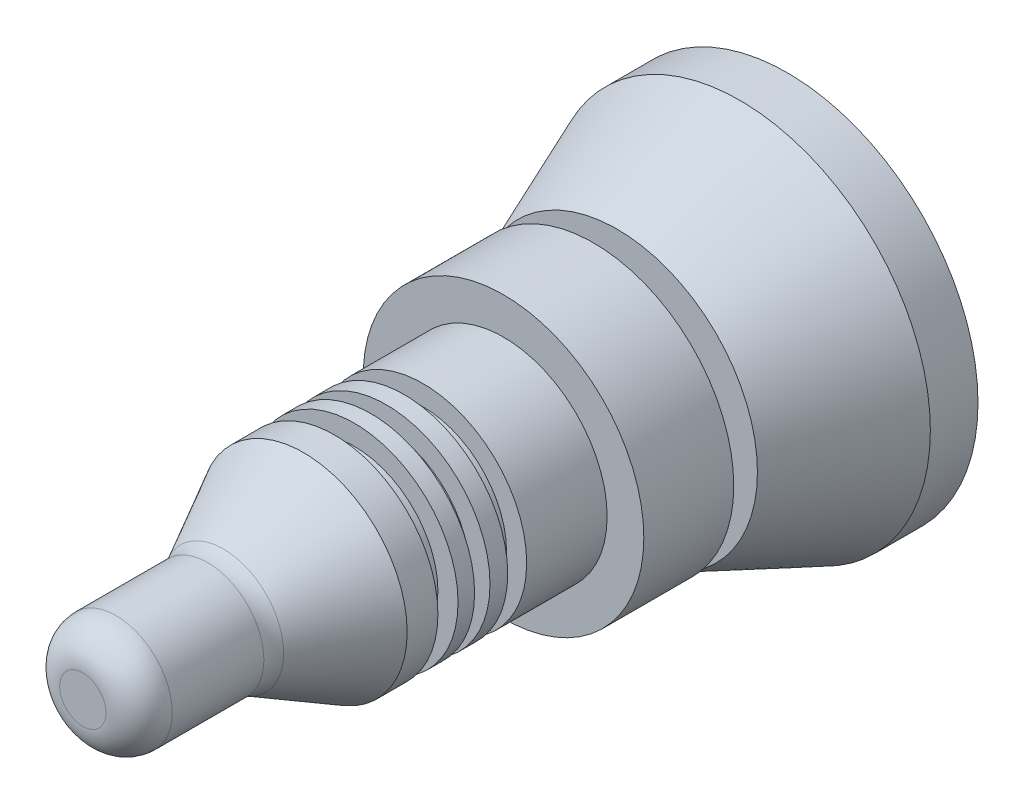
SolidWorks part; units mm, degrees
ref_plane "Plane1" through (0, 0, 0) normal (0, 0, 1) x (1, 0, 0)
ref_plane "Plane2" through (0, 0, 0) normal (0, 1, 0) x (1, 0, 0)
ref_plane "Plane3" through (0, 0, 0) normal (1, 0, 0) x (0, 0, -1)
sketch "Sketch2" plane through (0, 0, 0) normal (1, 0, 0) x (0, 0, -1)
  line L0 (0, 0) -> (0, 7)
  line L1 (10, 17) -> (37.6834, 17)
  line L2 (42.4386, 18.2029) -> (66.6645, 31.298)
  line L3 (66.6645, 31.298) -> (75.9582, 31.298)
  line L4 (75.9582, 31.298) -> (75.9582, 25.2214)
  line L5 (75.9582, 25.2214) -> (82.0349, 25.2214)
  line L6 (82.0349, 25.2214) -> (82.0349, 31.298)
  line L7 (82.0349, 31.298) -> (87.0392, 31.298)
  line L8 (87.0392, 31.298) -> (87.0392, 25.2214)
  line L9 (87.0392, 25.2214) -> (91.686, 25.2214)
  line L10 (91.686, 25.2214) -> (91.686, 31.298)
  line L11 (91.686, 31.298) -> (97.0478, 31.298)
  line L12 (97.0478, 31.298) -> (97.0478, 25.2214)
  line L13 (97.0478, 25.2214) -> (102.767, 25.2214)
  line L14 (102.767, 25.2214) -> (102.767, 31.298)
  line L15 (102.767, 31.298) -> (127.0736, 31.298)
  line L16 (127.0736, 31.298) -> (127.0736, 42.379)
  line L17 (127.0736, 42.379) -> (154.2398, 42.379)
  line L18 (154.2398, 42.379) -> (154.2398, 22.7192)
  line L19 (154.2398, 22.7192) -> (161.3888, 22.7192)
  line L20 (161.3888, 22.7192) -> (161.3888, 42.379)
  line L21 (161.3888, 42.379) -> (198.4471, 57.5552)
  line L22 (198.4471, 57.5552) -> (212.8364, 57.5552)
  line L23 (212.8364, 57.5552) -> (212.8364, 0)
  line L24 (212.8364, 0) -> (0, 0)
  line L25 (-62.7325, 0) -> (253.3876, 0) construction
  arc A0 (10, 17) -> (0, 7) centre (10, 7) ccw
  arc A1 (37.6834, 17) -> (42.4386, 18.2029) centre (37.6834, 27) ccw
  dimension "D2" = 34
revolve "Revolve1" add sketch "Sketch2" angle 360 about L25
